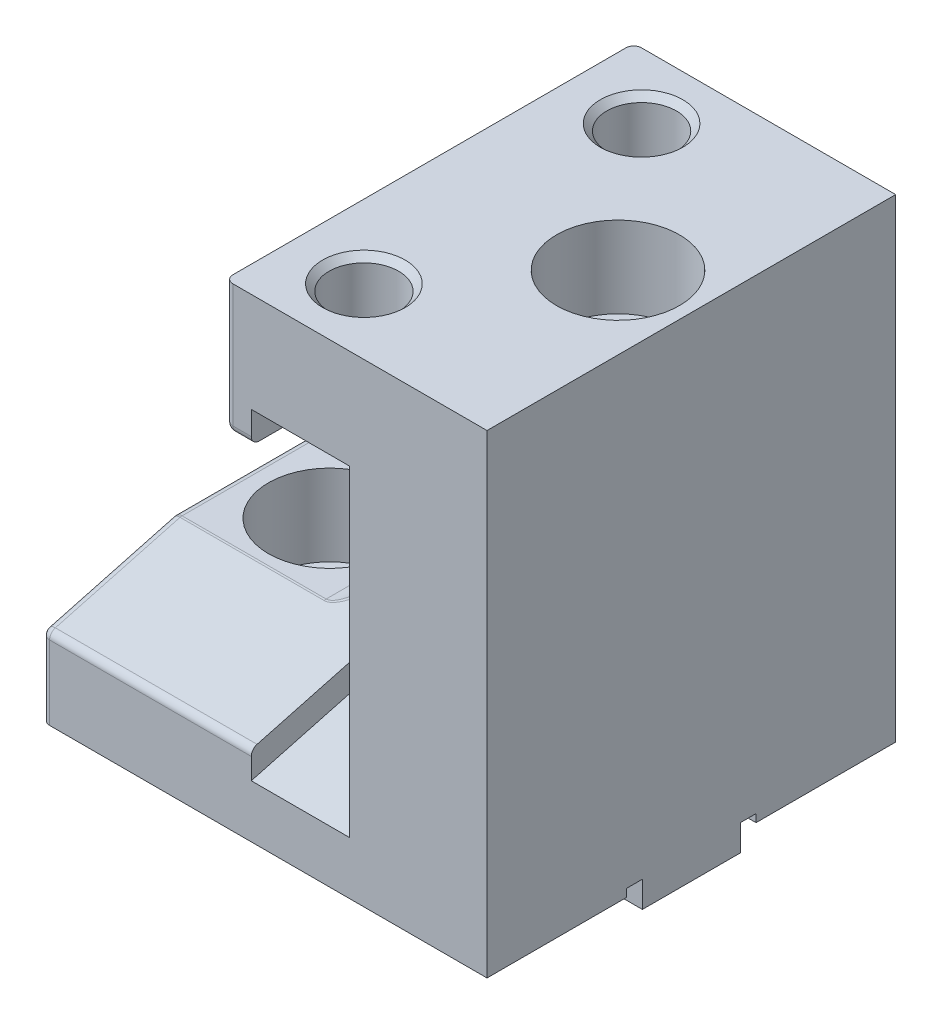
SolidWorks part; units mm, degrees
ref_plane "Front XY" through (0, 0, 0) normal (0, 0, 1) x (1, 0, 0)
ref_plane "Top XZ" through (0, 0, 0) normal (0, 1, 0) x (1, 0, 0)
ref_plane "Right YZ" through (0, 0, 0) normal (1, 0, 0) x (0, 0, -1)
sketch "Sketch1" plane through (0, 0, 0) normal (0, 0, 1) x (1, 0, 0)
  line L0 (0, 0) -> (0, 91.948)
  line L1 (0, 91.948) -> (-50.8, 91.948)
  line L2 (-50.8, 91.948) -> (-50.8, 66.548)
  line L3 (-50.8, 66.548) -> (-45.72, 66.548)
  line L4 (-45.72, 66.548) -> (-45.72, 72.644)
  line L5 (-45.72, 72.644) -> (-26.67, 72.644)
  line L6 (-26.67, 72.644) -> (-26.67, 0)
  line L7 (-26.67, 0) -> (0, 0)
  dimension "D1" = 50.8
  dimension "D2" = 19.05
  dimension "D3" = 5.08
  dimension "D4" = 91.948
  dimension "D5" = 72.644
  dimension "D6" = 25.4
extrude "Extrude1" add sketch "Sketch1" along normal blind 79.248
sketch "Sketch2" plane through (-26.67, 0, 0) normal (-1, 0, 0) x (0, 0, 1)
  line L0 (0, 0) -> (0, 31.496)
  line L1 (0, 72.644) -> (0, 0) construction
  line L2 (0, 31.496) -> (79.248, 10.2616)
  line L3 (79.248, 72.644) -> (79.248, 0) construction
  line L4 (79.248, 10.2616) -> (79.248, 0)
  line L5 (79.248, 0) -> (0, 0)
  dimension "D1" = 15
  dimension "D2" = 31.496
extrude "Extrude2" add sketch "Sketch2" along normal up to surface (19.05 mm away)
sketch "Sketch3" plane through (-45.72, 0, 0) normal (-1, 0, 0) x (0, 0, 1)
  line L0 (79.248, 10.2616) -> (0, 31.496) construction
  line L4 (0, 31.496) -> (0, 0)
  line L5 (0, 0) -> (79.248, 0)
  line L6 (79.248, 0) -> (79.248, 10.2616)
  line L7 (79.248, 10.2616) -> (0, 31.496)
  line L8 (0, 36.7552) -> (0, 0)
  line L9 (0, 0) -> (79.248, 0)
  line L10 (79.248, 0) -> (79.248, 15.5208)
  line L11 (79.248, 15.5208) -> (0, 36.7552)
  dimension "D2" = 5.08
  dimension "D1" = 0
extrude "Extrude3" add sketch "Sketch3" along normal up to surface (5.08 mm away)
sketch "Sketch4" plane through (-50.8, 0, 0) normal (-1, 0, 0) x (0, 0, 1)
  line L0 (0, 0) -> (0, 22.352)
  line L1 (0, 0) -> (0, 36.7552) construction
  line L2 (0, 22.352) -> (53.7535, 22.352)
  line L3 (0, 36.7552) -> (79.248, 15.5208) construction
  line L4 (53.7535, 22.352) -> (79.248, 15.5208)
  line L5 (79.248, 15.5208) -> (79.248, 0)
  line L6 (79.248, 0) -> (0, 0)
  dimension "D1" = 22.352
extrude "Extrude4" add sketch "Sketch4" along normal offset from surface (35.56 mm away) 86.36
sketch "Sketch5" plane through (-86.36, 0, 0) normal (-1, 0, 0) x (0, 0, 1)
  line L0 (0, 0) -> (79.248, 0) construction
  line L1 (30.1308, -3.556) -> (49.1172, -3.556)
  line L2 (30.1308, -3.556) -> (30.1308, 0)
  line L3 (30.1308, 0) -> (49.1172, 0)
  line L4 (49.1172, -3.556) -> (49.1172, 0)
  line L5 (30.1308, -3.556) -> (49.1172, 0) construction
  line L6 (30.1308, 0) -> (49.1172, -3.556) construction
  line L7 (39.624, -1.778) -> (39.624, 0) construction
  line L8 (79.248, 91.948) -> (0, 91.948) construction
  point P0 (39.624, -1.778)
  dimension "D1" = 18.9865
  dimension "D2" = 95.504
extrude "Extrude5" add sketch "Sketch5" against normal through all
sketch "Sketch6" plane through (-86.36, 0, 0) normal (-1, 0, 0) x (0, 0, 1)
  line L1 (49.1172, 0) -> (52.1653, 0)
  line L2 (49.1172, 0) -> (49.1172, 1.524)
  line L3 (49.1172, 1.524) -> (52.1653, 1.524)
  line L4 (52.1653, 0) -> (52.1653, 1.524)
  line L5 (30.1307, 0) -> (27.0827, 0)
  line L6 (30.1307, 0) -> (30.1307, 1.524)
  line L7 (30.1307, 1.524) -> (27.0827, 1.524)
  line L8 (27.0827, 0) -> (27.0827, 1.524)
  dimension "D1" = 1.524
  dimension "D2" = 3.048
extrude "Extrude6" cut sketch "Sketch6" against normal through all
sketch "Sketch7" plane through (0, 91.948, 0) normal (0, 1, 0) x (1, 0, 0)
  line L0 (-14.224, -39.624) -> (-50.8, -39.624) construction
  line L1 (-50.8, -79.248) -> (-50.8, 0) construction
  line L2 (0, -79.248) -> (0, 0) construction
  circle A0 centre (-14.224, -39.624) radius 7.9375 construction
  dimension "D1" = 15.875
  dimension "D2" = 14.224
hole_wizard "CBORE for 5/8 Socket Head Cap Screw1" positions "3DSketch1" profile "Sketch8" counterbore size "5/8" standard "Ansi Inch"
sketch3d "3DSketch1"
  line L0 (-14.224, 91.948, 39.624) -> (-70.104, 22.352, 39.624) construction
  line L1 (-14.224, 91.948, 39.624) -> (-70.104, 91.948, 39.624) construction
  point P0 (-14.224, 91.948, 39.624)
  point P3 (-70.104, 22.352, 39.624)
  dimension "D1" = 55.88
sketch "Sketch8" plane through (-14.224, 91.948, 39.624) normal (1, 0, 0) x (0, 0, 1)
  line L0 (0, 0) -> (0, 95.504)
  line L1 (0, 95.504) -> (7.9375, 95.504)
  line L3 (7.9375, 95.504) -> (7.9375, 15.748)
  line L4 (7.9375, 15.748) -> (11.9126, 15.748)
  line L5 (11.9126, 15.748) -> (11.9126, 0)
  line L7 (11.9126, 0) -> (0, 0)
  line L11 (0, -6.35) -> (0, 107.95) construction
  dimension "Thru Hole Dia." = 15.875
  dimension "Thru Hole Depth" = 95.504
  dimension "C'Bore Dia." = 23.8252
  dimension "C'Bore Depth" = 15.748
hole_wizard "5/8-11 Tapped Hole1" positions "Sketch10" profile "Sketch9" tap size "5/8-11" standard "Ansi Inch"
sketch "Sketch10" plane through (0, 91.948, 0) normal (0, 1, 0) x (-1, 0, 0)
  line L0 (36.576, 66.548) -> (36.576, 12.7) construction
  line L1 (14.224, 39.624) -> (36.576, 39.624) construction
  point P0 (36.576, 12.7)
  point P1 (36.576, 66.548)
  dimension "D1" = 22.352
  dimension "D2" = 53.848
sketch "Sketch9" plane through (-36.576, 91.948, 12.7) normal (1, 0, 0) x (0, 0, 1)
  line L0 (0, 0) -> (0, 19.304)
  line L1 (0, 19.304) -> (6.7462, 19.304)
  line L2 (6.7462, 19.304) -> (6.7462, 1.2548)
  line L3 (6.7462, 1.2548) -> (8.001, 0)
  line L5 (8.001, 0) -> (0, 0)
  line L6 (-6.7462, 1.2548) -> (-8.001, 0) construction
  line L11 (0, -6.35) -> (0, 107.95) construction
  dimension "Thru Tap Drill Dia." = 13.4925
  dimension "Thru Tap Drill Depth" = 19.304
  dimension "Near C'Sink Dia." = 16.002
  dimension "Near C'Sink Angle" = 90
fillet "Fillet1" radius 6.096 1 edges at (-50.8, 22.352, 26.8767)
fillet "Fillet2" radius 1.524 17 edges at (-50.8, 32.6016, 0) (-52.5855, 24.1375, 0) (-52.5855, 24.1375, 47.09) (-86.36, 11.176, 0) (-71.628, 22.352, 53.7535) (-86.36, 22.352, 26.8767) (-86.36, 18.9364, 66.5007) (-66.04, 15.5208, 79.248) (-86.36, 7.7604, 79.248) (-48.26, 66.548, 0) (-48.26, 66.548, 79.248) (-50.8, 66.548, 39.624) (-50.8, 79.248, 0) (-50.8, 79.248, 79.248) (-48.26, 36.7552, 0) (-71.628, 22.352, 0) (-50.8, 32.6016, 15.5015)
